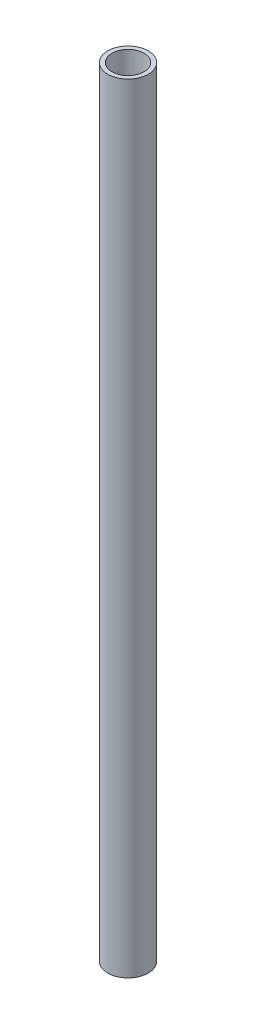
SolidWorks part; units mm, degrees
ref_plane "Front Plane" through (0, 0, 0) normal (0, 0, 1) x (1, 0, 0)
ref_plane "Top Plane" through (0, 0, 0) normal (0, 1, 0) x (1, 0, 0)
ref_plane "Right Plane" through (0, 0, 0) normal (1, 0, 0) x (0, 0, -1)
sketch "Sketch1" plane through (0, 0, 0) normal (0, 1, 0) x (1, 0, 0)
  circle A0 centre (0, 0) radius 7.9375
  circle A1 centre (0, 0) radius 6.2865
  dimension "D1" = 15.875
  dimension "D2" = 12.573
extrude "Boss-Extrude1" add sketch "Sketch1" along normal blind 304.8
